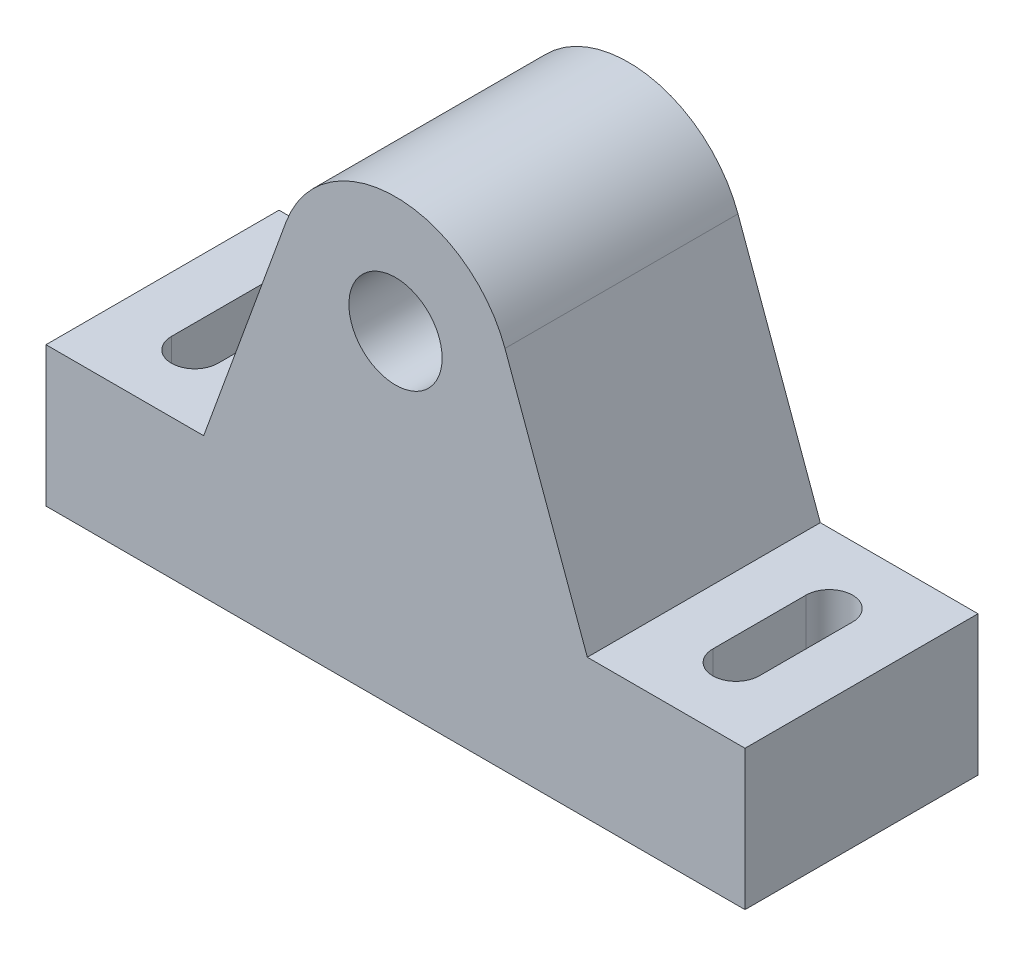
SolidWorks part; units mm, degrees
ref_plane "Plan de face" through (0, 0, 0) normal (0, 0, 1) x (1, 0, 0)
ref_plane "Plan de dessus" through (0, 0, 0) normal (0, 1, 0) x (1, 0, 0)
ref_plane "Plan de droite" through (0, 0, 0) normal (1, 0, 0) x (0, 0, -1)
sketch "Esquisse1" plane through (0, 0, 0) normal (0, 0, 1) x (1, 0, 0)
  line L0 (75, 0) -> (-75, 0)
  line L1 (-75, 0) -> (-75, 30)
  line L2 (-75, 30) -> (-41.1633, 30)
  line L3 (-41.1633, 30) -> (-23.4923, 78.5505)
  line L4 (0, 95) -> (0, 0) construction
  line L5 (75, 0) -> (75, 30)
  line L6 (75, 30) -> (41.1633, 30)
  line L7 (41.1633, 30) -> (23.4923, 78.5505)
  arc A0 (-23.4923, 78.5505) -> (23.4923, 78.5505) centre (0, 70) cw
  circle A1 centre (0, 70) radius 10
  dimension "D1" = 30
  dimension "D2" = 25
  dimension "D6" = 20
  dimension "D3" = 20
  dimension "D4" = 70
  dimension "D5" = 150
extrude "Boss.-Extru.1" add sketch "Esquisse1" along normal mid plane 50 contours L3 A0 L7 L6 L5 L0 L1 L2 | A1
sketch "Esquisse2" plane through (0, 30, 0) normal (0, 1, 0) x (1, 0, 0)
  line L0 (-58.0816, -10) -> (-58.0816, 10) construction
  line L1 (-63.0816, -10) -> (-63.0816, 10)
  line L2 (-53.0816, -10) -> (-53.0816, 10)
  line L3 (-75, 25) -> (-41.1633, 25) construction
  line L4 (-75, 25) -> (-41.1633, 25) construction
  line L5 (0, 25) -> (0, -25) construction
  line L6 (23.4923, 25) -> (-23.4923, 25) construction
  line L7 (-23.4923, -25) -> (23.4923, -25) construction
  line L8 (58.0816, -10) -> (58.0816, 10) construction
  line L9 (63.0816, -10) -> (63.0816, 10)
  line L10 (53.0816, -10) -> (53.0816, 10)
  arc A0 (-63.0816, -10) -> (-53.0816, -10) centre (-58.0816, -10) ccw
  arc A1 (-53.0816, 10) -> (-63.0816, 10) centre (-58.0816, 10) ccw
  arc A2 (63.0816, -10) -> (53.0816, -10) centre (58.0816, -10) cw
  arc A3 (53.0816, 10) -> (63.0816, 10) centre (58.0816, 10) cw
  point P2 (-58.0816, 0)
  point P11 (-58.0816, 25)
  point P12 (58.0816, 0)
  dimension "D2" = 5
  dimension "D1" = 20
extrude "Enlèv. mat.-Extru.1" cut sketch "Esquisse2" against normal through all
